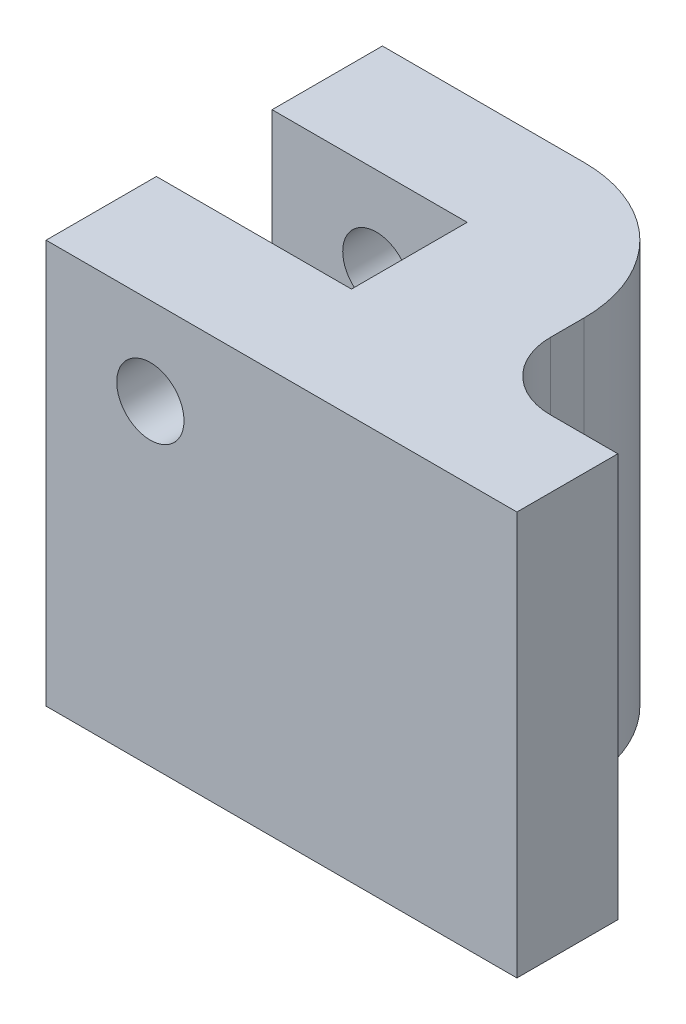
SolidWorks part; units mm, degrees
ref_plane "Front" through (0, 0, 0) normal (0, 0, 1) x (1, 0, 0)
ref_plane "Top" through (0, 0, 0) normal (0, 1, 0) x (1, 0, 0)
ref_plane "Right" through (0, 0, 0) normal (1, 0, 0) x (0, 0, -1)
sketch "Sketch1" plane through (0, 0, 0) normal (0, 0, 1) x (1, 0, 0)
  line L0 (9.8425, 0) -> (9.8425, 29.845) construction
  line L1 (0, 0) -> (44.45, 0)
  line L2 (0, 0) -> (0, 38.1)
  line L3 (0, 38.1) -> (44.45, 38.1)
  line L4 (44.45, 0) -> (44.45, 38.1)
  circle A0 centre (9.8425, 29.845) radius 3.175
  point P10 (11.4555, 47.625)
  dimension "D4" = 6.35
  dimension "D1" = 44.45
  dimension "D2" = 38.1
  dimension "D3" = 29.845
  dimension "D5" = 9.8425
extrude "Boss-Extrude1" add sketch "Sketch1" along normal blind 31.75
sketch "Sketch2" plane through (0, 38.1, 0) normal (0, 1, 0) x (1, 0, 0)
  line L1 (18.415, -10.414) -> (0, -10.414)
  line L2 (18.415, -10.414) -> (18.415, -21.336)
  line L3 (18.415, -21.336) -> (0, -21.336)
  line L4 (0, -10.414) -> (0, -21.336)
  line L5 (0, -15.875) -> (38.1, -15.875) construction
  line L6 (0, -31.75) -> (0, 0) construction
  point P10 (0, -15.875)
  dimension "D1" = 10.922
  dimension "D2" = 18.415
extrude "Cut-Extrude1" cut sketch "Sketch2" against normal blind 16.7132
sketch "Sketch3" plane through (0, 0, 0) normal (0, -1, 0) x (1, 0, 0)
  line L0 (0, 15.875) -> (44.45, 15.875) construction
  line L1 (12.7, 26.035) -> (38.1, 26.035) construction
  line L2 (12.7, 26.035) -> (12.7, 5.715) construction
  line L3 (12.7, 5.715) -> (38.1, 5.715) construction
  line L4 (38.1, 26.035) -> (38.1, 5.715) construction
  line L5 (0, 31.75) -> (0, 0) construction
  line L6 (44.45, 31.75) -> (44.45, 0) construction
  circle A0 centre (12.7, 26.035) radius 2.0193
  circle A1 centre (38.1, 26.035) radius 2.0193
  circle A2 centre (38.1, 5.715) radius 2.0193
  circle A3 centre (12.7, 5.715) radius 2.0193
  point P10 (38.1, 15.875)
  dimension "D2" = 4.0386
  dimension "D1" = 25.4
  dimension "D3" = 20.32
  dimension "D4" = 6.35
extrude "Cut-Extrude2" cut sketch "Sketch3" against normal blind 19.05
sketch "Sketch4" plane through (0, 0, 0) normal (0, -1, 0) x (1, 0, 0)
  line L0 (44.45, 31.75) -> (44.45, 0) construction
  line L1 (44.45, 22.225) -> (38.1, 22.225)
  line L2 (44.45, 22.225) -> (44.45, 9.525)
  line L3 (44.45, 9.525) -> (38.1, 9.525)
  line L4 (31.75, 22.225) -> (31.75, 9.525) construction
  line L5 (0, 15.875) -> (44.45, 15.875) construction
  line L6 (0, 31.75) -> (0, 0) construction
  line L7 (31.75, 15.875) -> (31.75, 0)
  line L9 (0, 0) -> (44.45, 0) construction
  line L10 (31.75, 0) -> (44.45, 0)
  line L11 (44.45, 0) -> (44.45, 9.525)
  arc A0 (38.1, 22.225) -> (38.1, 9.525) centre (38.1, 15.875) ccw
  point P13 (31.75, 15.875)
  dimension "D3" = 6.35
  dimension "D2" = 6.35
  dimension "D1" = 12.7
extrude "Cut-Extrude3" cut sketch "Sketch4" against normal through all contours L1 A0 L3 M12 | A0 L7 L3 M11 M12 M8
fillet "Fillet1" radius 12.7 1 edges at (31.75, 19.05, 0)
